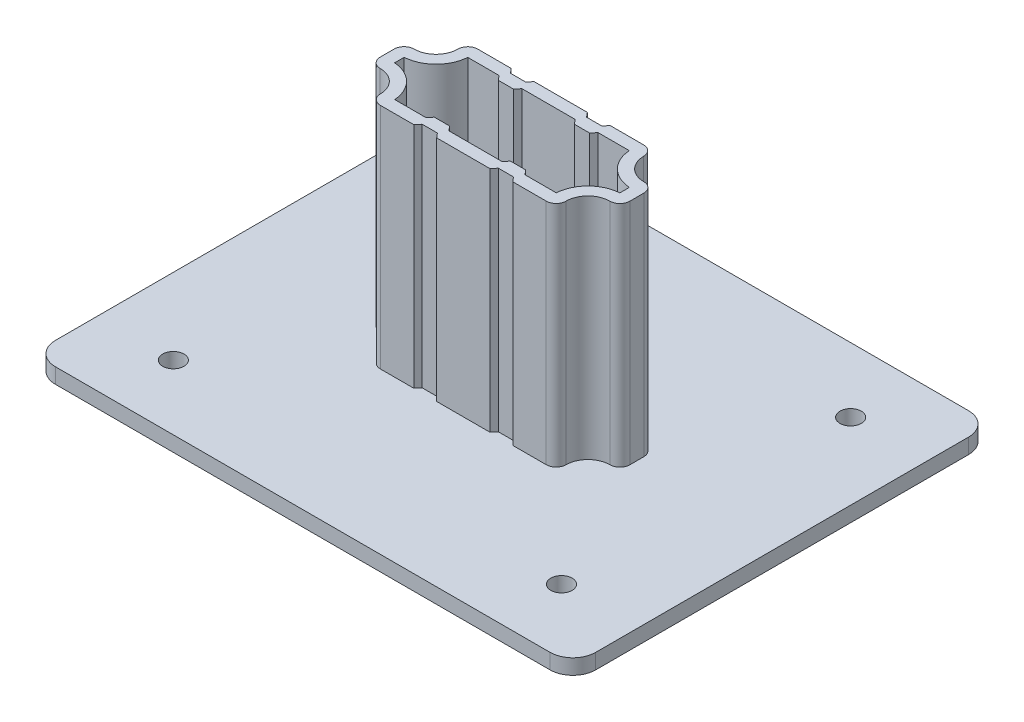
SolidWorks part; units mm, degrees
ref_plane "Alzado" through (0, 0, 0) normal (0, 0, 1) x (1, 0, 0)
ref_plane "Planta" through (0, 0, 0) normal (0, 1, 0) x (1, 0, 0)
ref_plane "Vista lateral" through (0, 0, 0) normal (1, 0, 0) x (0, 0, -1)
sketch "Croquis2" plane through (0, 0, 0) normal (0, 1, 0) x (1, 0, 0)
  line L0 (-183.2758, 0) -> (156.0252, 0) construction
  line L1 (0, 113.0945) -> (0, -113.0945) construction
  line L4 (-17.4827, 32) -> (17.4827, 32)
  line L5 (20, 29) -> (30, 29)
  line L6 (75.5, -25.5908) -> (46.8795, -4.5905) construction
  line L8 (82, 4.5905) -> (82, -4.5905)
  line L9 (20, 29) -> (17.4827, 32)
  line L10 (30, 29) -> (32.5173, 32)
  line L11 (32.5173, 32) -> (54.5, 32)
  line L14 (32.5173, -32) -> (54.5, -32)
  line L15 (30, -29) -> (32.5173, -32)
  line L16 (20, -29) -> (17.4827, -32)
  line L17 (20, -29) -> (30, -29)
  line L18 (-17.4827, -32) -> (17.4827, -32)
  line L20 (-17.4827, -24) -> (17.4827, -24)
  line L24 (-20, -29) -> (-30, -29)
  line L25 (-20, -29) -> (-17.4827, -32)
  line L26 (-30, -29) -> (-32.5173, -32)
  line L27 (-32.5173, -32) -> (-54.5, -32)
  line L28 (-32.5173, 32) -> (-54.5, 32)
  line L29 (-30, 29) -> (-32.5173, 32)
  line L30 (-20, 29) -> (-17.4827, 32)
  line L31 (-82, 4.5905) -> (-82, -4.5905)
  line L32 (-20, 29) -> (-30, 29)
  line L34 (9.5117, 24) -> (17.4827, 24)
  line L37 (-53.0563, 24) -> (-32.5173, 24)
  line L40 (-30, 21) -> (-32.5173, 24)
  line L41 (-20, 21) -> (-17.4827, 24)
  line L42 (-20, 21) -> (-30, 21)
  line L44 (20, 21) -> (17.4827, 24)
  line L45 (20, 21) -> (30, 21)
  line L46 (30, 21) -> (32.5173, 24)
  line L47 (-20, -21) -> (-17.4827, -24)
  line L48 (-20, -21) -> (-30, -21)
  line L49 (-30, -21) -> (-32.5173, -24)
  line L50 (20, -21) -> (30, -21)
  line L51 (30, -21) -> (32.5173, -24)
  line L52 (20, -21) -> (17.4827, -24)
  line L55 (-17.4827, 24) -> (17.4827, 24)
  line L57 (32.5173, 24) -> (53.0501, 24)
  line L58 (-74, -3.1408) -> (-74, 3.1408)
  line L59 (-53.0563, -24) -> (-32.5173, -24)
  line L60 (32.5173, 24) -> (53.0501, 24)
  line L61 (32.5173, -24) -> (53.0563, -24)
  line L66 (74, -3.1408) -> (73.9996, 3.1346)
  line L67 (74, -3.1408) -> (73.9996, 3.1346)
  arc A3 (61, 25.5) -> (54.5, 32) centre (54.5, 25.5) ccw
  arc A6 (82, 4.5905) -> (75.5, 11.0905) centre (75.5, 4.5905) ccw
  arc A7 (61, 25.5) -> (75.5, 11.0905) centre (75.5, 25.5908) ccw
  arc A8 (61, -25.5) -> (75.5, -11.0905) centre (75.5, -25.5908) cw
  arc A9 (82, -4.5905) -> (75.5, -11.0905) centre (75.5, -4.5905) cw
  arc A12 (61, -25.5) -> (54.5, -32) centre (54.5, -25.5) cw
  arc A17 (-61, -25.5) -> (-54.5, -32) centre (-54.5, -25.5) ccw
  arc A20 (-82, -4.5905) -> (-75.5, -11.0905) centre (-75.5, -4.5905) ccw
  arc A21 (-61, -25.5) -> (-75.5, -11.0905) centre (-75.5, -25.5908) ccw
  arc A22 (-61, 25.5) -> (-75.5, 11.0905) centre (-75.5, 25.5908) cw
  arc A23 (-82, 4.5905) -> (-75.5, 11.0905) centre (-75.5, 4.5905) cw
  arc A26 (-61, 25.5) -> (-54.5, 32) centre (-54.5, 25.5) cw
  arc A31 (74, -3.1408) -> (53.0563, -24) centre (75.5, -25.5908) ccw
  arc A32 (-53.0563, -24) -> (-74, -3.1408) centre (-75.5, -25.5908) ccw
  arc A33 (-74, 3.1408) -> (-53.0563, 24) centre (-75.5, 25.5908) ccw
  arc A34 (-74, 48.0407) -> (-75.5, 48.0908) centre (-75.5, 25.5908) ccw
  arc A35 (-98, 25.5908) -> (-97.9499, 24.0908) centre (-75.5, 25.5908) ccw
  arc A38 (53.0501, 24) -> (73.9996, 3.1346) centre (75.5, 25.5908) ccw
  point P6 (0, 0)
  point P8 (-90, 0)
  point P9 (0, 40)
  point P56 (82, 0)
  point P58 (90, 0)
  point P94 (0, -40)
  point P95 (0, -32)
  point P102 (0, 32)
  point P103 (-82, 0)
  dimension "D5" = 6.5
  dimension "D6" = 6.5
  dimension "D3" = 14.5003
  dimension "D4" = 22.5
  dimension "D10" = 10
  dimension "D11" = 20
  dimension "D12" = 3
  dimension "D13" = 50
  dimension "D14" = 50
  dimension "D16" = 8
extrude "Saliente-Extruir1" add sketch "Croquis2" along normal blind 150 contours A26 A22 A23 L31 A20 A21 A17 L27 L26 L24 L25 L18 L16 L17 L15 L14 A12 A8 A9 L8 A6 A7 A3 L11 L10 L5 L9 L4 L30 L32 L29 L28 L57 A38 L66 A31 L61 L51 L50 L52 L20 L47 L48 L49 L59 A32 L58 A33 L37 L40
sketch "Croquis3" plane through (0, 0, 0) normal (0, -1, 0) x (1, 0, 0)
  line L5 (177.5, 137.5) -> (-177.5, 137.5)
  line L6 (177.5, 137.5) -> (177.5, -137.5)
  line L7 (177.5, -137.5) -> (-177.5, -137.5)
  line L8 (-177.5, 137.5) -> (-177.5, -137.5)
  line L9 (177.5, 137.5) -> (-177.5, -137.5) construction
  line L10 (177.5, -137.5) -> (-177.5, 137.5) construction
  point P0 (0, 0)
  point P1 (0, 0)
  dimension "D1" = 275
  dimension "D2" = 355
extrude "Saliente-Extruir4" add sketch "Croquis3" along normal blind 10
fillet "Redondeo1" radius 15 4 edges at (-177.5, -5, -137.5) (177.5, -5, -137.5) (177.5, -5, 137.5) (-177.5, -5, 137.5)
sketch "Croquis6" plane through (0, -10, 0) normal (0, -1, 0) x (1, 0, 0)
  line L1 (0, 0) -> (489.2001, 0) construction
  circle A0 centre (-127.5, -95) radius 7
  circle A1 centre (127.5, -95) radius 7
  circle A2 centre (127.5, 95) radius 7
  circle A3 centre (-127.5, 95) radius 7
  point P9 (0, 0)
  dimension "D1" = 14
  dimension "D2" = 95
  dimension "D3" = 95
  dimension "D4" = 255
  dimension "D5" = 127.5
extrude "Cortar-Extruir1" cut sketch "Croquis6" against normal blind 10
